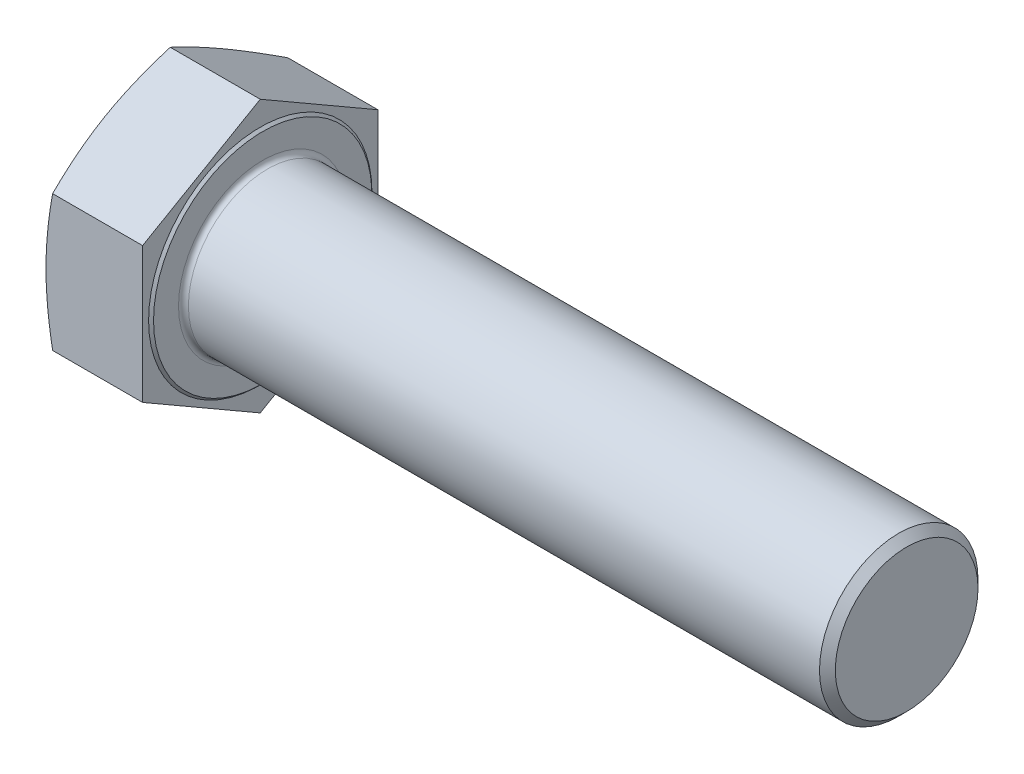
SolidWorks part; units mm, degrees
ref_plane "Front" through (0, 0, 0) normal (0, 0, 1) x (1, 0, 0)
ref_plane "Top" through (0, 0, 0) normal (0, 1, 0) x (1, 0, 0)
ref_plane "Right" through (0, 0, 0) normal (1, 0, 0) x (0, 0, -1)
sketch "Sketch2" plane through (0, 0, 0) normal (1, 0, 0) x (0, 0, -1)
  line L1 (0, -54.8483) -> (47.5, -27.4241)
  line L2 (47.5, -27.4241) -> (47.5, 27.4241)
  line L3 (47.5, 27.4241) -> (0, 54.8483)
  line L4 (0, 54.8483) -> (-47.5, 27.4241)
  line L5 (-47.5, 27.4241) -> (-47.5, -27.4241)
  line L6 (-47.5, -27.4241) -> (0, -54.8483)
  circle A0 centre (0, 0) radius 47.5 construction
  dimension "s" = 95
extrude "BaseHead" add sketch "Sketch2" along normal blind 40
sketch "Sketch3" plane through (0, 0, 0) normal (0, 0, 1) x (1, 0, 0)
  line L0 (40, 54.8483) -> (40, 44.08)
  line L2 (40, 44.08) -> (39, 45.08)
  line L3 (39, 45.08) -> (39, 54.8483)
  line L5 (39, 54.8483) -> (40, 54.8483)
  line L6 (-0.9571, 0) -> (7.6478, 0) construction
  line L7 (40, 54.8483) -> (0, 54.8483) construction
  dimension "D1" = 45
  dimension "c" = 1
  dimension "dw" = 88.16
revolve "BearingFace" cut sketch "Sketch3" angle 360 about L6
sketch "Sketch4" plane through (0, 0, 0) normal (0, 0, 1) x (1, 0, 0)
  line L0 (-0.4935, 0) -> (3.5626, 0) construction
  line L2 (0, 54.8483) -> (2.6746, 54.8483)
  line L4 (2.6746, 54.8483) -> (0, 47.5)
  line L6 (0, 47.5) -> (0, 54.8483)
  line L7 (39, 54.8483) -> (0, 54.8483) construction
  dimension "D1" = 20
  dimension "D2" = 95
revolve "HeadChamfer" cut sketch "Sketch4" angle 360 about L0
ref_plane "Plane1" through (147, 0, 0) normal (1, 0, 0) x (0, 0, -1)
sketch "Sketch5" plane through (40, 0, 0) normal (1, 0, 0) x (0, 0, -1)
  circle A0 centre (0, 0) radius 32
  dimension "d" = 64
extrude "BaseBody" add sketch "Sketch5" along normal blind 260
chamfer "Chamfer1" distance 3.2 angle 45 1 edges at (300, 0, -32)
fillet "HeadFillet" radius 2 1 edges at (40, 0, 32)
equation "\"D2@Sketch4\" = \"s@Sketch2\""
equation "\"D1@Chamfer1\" = 0.05 * \"d@Sketch5\""
equation "\"D1@ThreadCosmetic1\" = \"l@BaseBody\" - \"lg@Plane1\""
